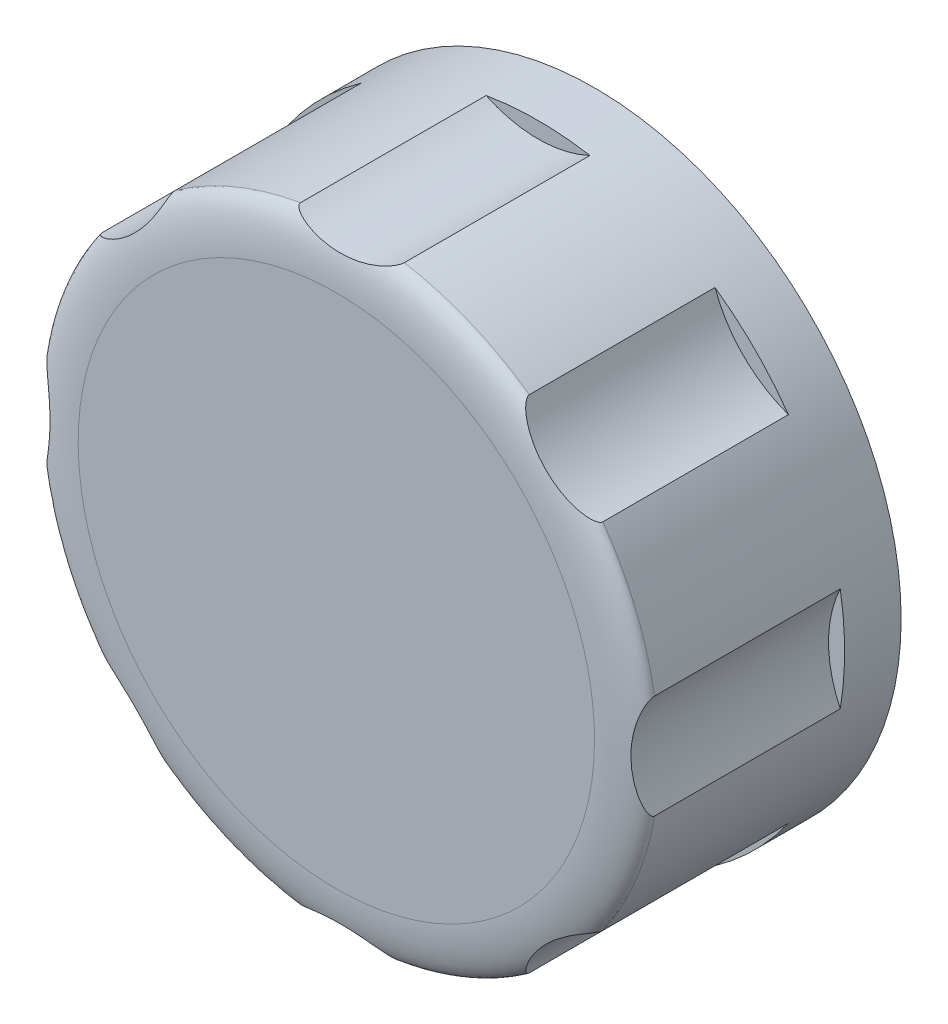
SolidWorks part; units mm, degrees
ref_plane "正面" through (0, 0, 0) normal (0, 0, 1) x (1, 0, 0)
ref_plane "平面" through (0, 0, 0) normal (0, 1, 0) x (1, 0, 0)
ref_plane "右側面" through (0, 0, 0) normal (1, 0, 0) x (0, 0, -1)
sketch "ｽｹｯﾁ1" plane through (0, 0, 0) normal (0, 0, 1) x (1, 0, 0)
  circle A0 centre (0, 0) radius 19
  dimension "D1" = 38
extrude "ﾎﾞｽ - 押し出し1" add sketch "ｽｹｯﾁ1" along normal blind 16
fillet "ﾌｨﾚｯﾄ1" radius 1 1 edges at (19, 0, 16)
sketch "ｽｹｯﾁ2" plane through (0, 0, 16) normal (0, 0, 1) x (1, 0, 0)
  circle A0 centre (0, 25.5) radius 7.5
  circle A1 centre (0, 0) radius 19 construction
  dimension "D1" = 15
  dimension "D2" = 25.5
extrude "ｶｯﾄ - 押し出し1" cut sketch "ｽｹｯﾁ2" against normal blind 12.5
pattern_circular "円形ﾊﾟﾀｰﾝ1" count 8 over 360 about axis through (0, 0, 0) along (0, 0, 1) of "ｶｯﾄ - 押し出し1"
sketch "ｽｹｯﾁ4" plane through (0, 0, 0) normal (0, 0, -1) x (-1, 0, 0)
  circle A0 centre (0, 0) radius 16.5
  dimension "D1" = 33
extrude "ｶｯﾄ - 押し出し2" cut sketch "ｽｹｯﾁ4" against normal blind 13
